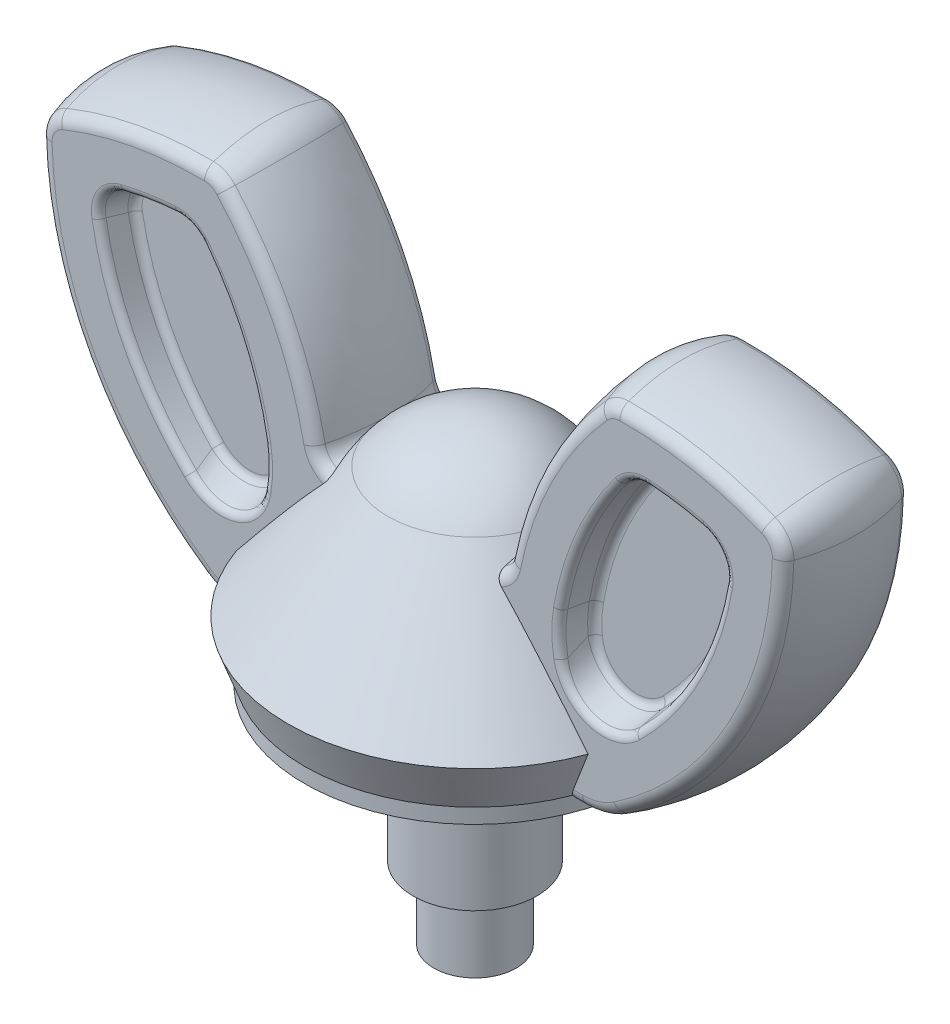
SolidWorks part; units mm, degrees
ref_plane "Front Plane" through (0, 0, 0) normal (0, 0, 1) x (1, 0, 0)
ref_plane "Top Plane" through (0, 0, 0) normal (0, 1, 0) x (1, 0, 0)
ref_plane "Right Plane" through (0, 0, 0) normal (1, 0, 0) x (0, 0, -1)
other "Configuration Table"
sketch "Sketch1" plane through (0, 0, 0) normal (0, 0, 1) x (1, 0, 0)
  line L0 (0, 10.7344) -> (0, 0) construction
  line L5 (4.826, 0) -> (-4.826, 0)
  line L6 (2.413, 5.08) -> (-2.413, 5.08)
  arc A11 (-2.413, 5.08) -> (-5.3975, 10.9034) centre (-13.1787, 3.2391) ccw
  arc A13 (-5.3975, 10.9034) -> (-10.795, 9.8298) centre (-6.0342, 0) ccw
  arc A24 (-10.795, 9.8298) -> (-6.0486, 0.3742) centre (0, 9.3295) ccw
  arc A26 (-4.826, 0) -> (-6.0486, 0.3742) centre (-4.826, 2.1844) cw
  arc A29 (4.826, 0) -> (6.0486, 0.3742) centre (4.826, 2.1844) ccw
  arc A34 (10.795, 9.8298) -> (6.0486, 0.3742) centre (0, 9.3295) cw
  arc A36 (5.3975, 10.9034) -> (10.795, 9.8298) centre (6.0342, 0) cw
  arc A37 (2.413, 5.08) -> (5.3975, 10.9034) centre (13.1787, 3.2391) cw
  point P19 (0, 0)
  point P27 (0, 5.08)
  point P29 (0, 5.08)
  point P44 (0, 5.08)
extrude "Extrude1" add sketch "Sketch1" along normal mid plane 3.556
fillet "Fillet4" radius 1.0922 4 edges at (10.795, 9.8298, 0) (5.3975, 10.9034, 0) (-5.3975, 10.9034, 0) (-10.795, 9.8298, 0)
sketch "Sketch2" plane through (0, 0, 1.778) normal (0, 0, 1) x (1, 0, 0)
  line L0 (0, 0) -> (0, 12.8329) construction
  line L1 (-4.826, 0) -> (4.826, 0) construction
  arc A10 (-4.1864, 4.7767) -> (-5.0416, 1.8652) centre (-7.5893, 4.1949) cw
  arc A11 (4.1864, 4.7767) -> (6.2055, 9.1212) centre (13.1787, 3.2391) cw
  arc A12 (6.2055, 9.1212) -> (8.9805, 8.634) centre (6.0342, 0) cw
  arc A13 (8.9805, 8.634) -> (5.0416, 1.8652) centre (0, 9.3295) cw
  arc A14 (4.1864, 4.7767) -> (5.0416, 1.8652) centre (7.5893, 4.1949) ccw
  arc A15 (-8.9805, 8.634) -> (-5.0416, 1.8652) centre (0, 9.3295) ccw
  arc A16 (-6.2055, 9.1212) -> (-8.9805, 8.634) centre (-6.0342, 0) ccw
  arc A17 (-4.1864, 4.7767) -> (-6.2055, 9.1212) centre (-13.1787, 3.2391) ccw
  arc A18 (-8.9805, 8.634) -> (-5.0416, 1.8652) centre (0, 9.3295) ccw
  arc A19 (-6.2055, 9.1212) -> (-8.9805, 8.634) centre (-6.0342, 0) ccw
  arc A20 (-4.1864, 4.7767) -> (-6.2055, 9.1212) centre (-13.1787, 3.2391) ccw
extrude "Cut-Extrude1" cut sketch "Sketch2" against normal blind 0.889 draft 10
fillet "Fillet1" radius 0.889 4 edges
fillet "Fillet6" radius 1.2446 2 edges
fillet "Fillet5" radius 0.3641 2 edges at (2.413, 5.08, 0) (-2.413, 5.08, 0)
fillet "Fillet3" radius 0.2223 28 edges at (7.4585, 9.011, 1.778) (7.4007, 8.8613, 0.889) (6.4621, 8.9114, 0.889) (8.6146, 8.3041, 0.889) (7.8855, 5.3103, 0.889) (4.2988, 4.3764, 0.889) (6.1282, 8.9579, 1.778) (8.7221, 8.5339, 1.778) (7.9776, 5.1471, 1.778) (4.1377, 4.1292, 1.778) (-4.2988, 4.3764, 0.889) (-7.8855, 5.3103, 0.889) (-8.5332, 8.4279, 0.889) (-7.4007, 8.8613, 0.889) (-6.1942, 8.7899, 0.889) (-4.1377, 4.1292, 1.778) (-7.9776, 5.1471, 1.778) (-8.7866, 8.4358, 1.778) (-7.4585, 9.011, 1.778) (-6.3795, 9.0717, 1.778) (4.9351, 6.7652, 0.889) (4.81, 6.8709, 1.778) (-4.9351, 6.7652, 0.889) (-4.81, 6.8709, 1.778) (4.9742, 2.938, 0.889) (5.0791, 2.5366, 1.778) (-5.2102, 2.8514, 0.889) (-5.0131, 2.5568, 1.778)
mirror "Mirror1" about plane through (0, 0, 0) normal (0, 0, 1) of "Fillet6", "Fillet3", "Fillet1", "Cut-Extrude1"
sketch "Sketch4" plane through (0, 0, 0) normal (1, 0, 0) x (0, 0, -1)
  line L1 (-1.778, 5.334) -> (1.778, 5.334)
  line L2 (-1.778, 4.4704) -> (-1.778, 5.334)
  line L4 (1.778, 0.3742) -> (1.778, 9.0918) construction
  line L6 (-1.778, 9.0918) -> (-1.778, 0.3742) construction
  line L7 (0, 5.715) -> (0, 0.381) construction
  line L9 (1.778, 4.4704) -> (1.778, 5.334)
  line L10 (-1.778, 5.08) -> (1.778, 5.08) construction
  arc A0 (-1.524, 4.826) -> (-1.778, 4.4704) centre (-1.4021, 4.4704) ccw
  arc A1 (1.524, 4.826) -> (-1.524, 4.826) centre (0, 0.381) ccw
  arc A2 (1.524, 4.826) -> (1.778, 4.4704) centre (1.4021, 4.4704) cw
  point P8 (0, 5.08)
sketch3d "3DSketch1"
  line L2 (-2.1102, 5.08, 1.778) -> (2.1102, 5.08, 1.778)
  line L3 (4.826, 0, 1.778) -> (-4.826, 0, 1.778)
  line L4 (-2.1102, 5.08, 1.778) -> (2.1102, 5.08, 1.778)
  line L5 (4.826, 0, 1.778) -> (-4.826, 0, 1.778)
  arc A15 (10.804, 9.0918, 1.778) -> (6.0486, 0.3742, 1.778) centre (0, 9.3295, 1.778) ccw
  arc A16 (10.1207, 10.1287, 1.778) -> (10.804, 9.0918, 1.778) centre (9.712, 9.1158, 1.778) ccw
  arc A17 (5.8682, 10.9207, 1.778) -> (10.1207, 10.1287, 1.778) centre (6.0342, 0, 1.778) ccw
  arc A18 (5.0743, 10.5608, 1.778) -> (5.8682, 10.9207, 1.778) centre (5.8848, 9.8287, 1.778) ccw
  arc A19 (2.4672, 5.3729, 1.778) -> (5.0743, 10.5608, 1.778) centre (13.1787, 3.2391, 1.778) ccw
  arc A20 (2.1102, 5.08, 1.778) -> (2.4672, 5.3729, 1.778) centre (2.1102, 5.4441, 1.778) ccw
  arc A21 (2.1102, 5.08, 1.778) -> (2.4672, 5.3729, 1.778) centre (2.1102, 5.4441, 1.778) ccw
  arc A22 (-5.0743, 10.5608, 1.778) -> (-2.4672, 5.3729, 1.778) centre (-13.1787, 3.2391, 1.778) ccw
  arc A23 (-5.8682, 10.9207, 1.778) -> (-5.0743, 10.5608, 1.778) centre (-5.8848, 9.8287, 1.778) ccw
  arc A24 (-10.1207, 10.1287, 1.778) -> (-5.8682, 10.9207, 1.778) centre (-6.0342, 0, 1.778) ccw
  arc A25 (-10.804, 9.0918, 1.778) -> (-10.1207, 10.1287, 1.778) centre (-9.712, 9.1158, 1.778) ccw
  arc A26 (-6.0486, 0.3742, 1.778) -> (-10.804, 9.0918, 1.778) centre (0, 9.3295, 1.778) ccw
  arc A27 (-4.826, 0, 1.778) -> (-6.0486, 0.3742, 1.778) centre (-4.826, 2.1844, 1.778) ccw
  arc A28 (6.0486, 0.3742, 1.778) -> (4.826, 0, 1.778) centre (4.826, 2.1844, 1.778) ccw
  arc A29 (10.804, 9.0918, 1.778) -> (6.0486, 0.3742, 1.778) centre (0, 9.3295, 1.778) ccw
  arc A30 (10.1207, 10.1287, 1.778) -> (10.804, 9.0918, 1.778) centre (9.712, 9.1158, 1.778) ccw
  arc A31 (5.8682, 10.9207, 1.778) -> (10.1207, 10.1287, 1.778) centre (6.0342, 0, 1.778) ccw
  arc A32 (5.0743, 10.5608, 1.778) -> (5.8682, 10.9207, 1.778) centre (5.8848, 9.8287, 1.778) ccw
  arc A33 (2.4672, 5.3729, 1.778) -> (5.0743, 10.5608, 1.778) centre (13.1787, 3.2391, 1.778) ccw
  arc A34 (-2.4672, 5.3729, 1.778) -> (-2.1102, 5.08, 1.778) centre (-2.1102, 5.4441, 1.778) ccw
  arc A35 (-2.4672, 5.3729, 1.778) -> (-2.1102, 5.08, 1.778) centre (-2.1102, 5.4441, 1.778) ccw
  arc A36 (-5.0743, 10.5608, 1.778) -> (-2.4672, 5.3729, 1.778) centre (-13.1787, 3.2391, 1.778) ccw
  arc A37 (-5.8682, 10.9207, 1.778) -> (-5.0743, 10.5608, 1.778) centre (-5.8848, 9.8287, 1.778) ccw
  arc A38 (-10.1207, 10.1287, 1.778) -> (-5.8682, 10.9207, 1.778) centre (-6.0342, 0, 1.778) ccw
  arc A39 (-10.804, 9.0918, 1.778) -> (-10.1207, 10.1287, 1.778) centre (-9.712, 9.1158, 1.778) ccw
  arc A40 (-6.0486, 0.3742, 1.778) -> (-10.804, 9.0918, 1.778) centre (0, 9.3295, 1.778) ccw
  arc A41 (-4.826, 0, 1.778) -> (-6.0486, 0.3742, 1.778) centre (-4.826, 2.1844, 1.778) ccw
  arc A42 (6.0486, 0.3742, 1.778) -> (4.826, 0, 1.778) centre (4.826, 2.1844, 1.778) ccw
  point P3 (2.1102, 5.4441, 2.1421)
  point P5 (2.1102, 5.4441, 2.1421)
  point P11 (-2.1102, 5.4441, 2.1421)
  point P13 (-2.1102, 5.4441, 2.1421)
  point P43 (0, 9.3295, -9.0286)
  point P46 (9.712, 9.1158, 0.6858)
  point P48 (6.0342, 0, -9.144)
  point P50 (5.8848, 9.8287, 0.6858)
  point P52 (13.1787, 3.2391, -9.144)
  point P58 (-13.1787, 3.2391, -9.144)
  point P60 (-5.8848, 9.8287, 0.6858)
  point P62 (-6.0342, 0, -9.144)
  point P64 (-9.712, 9.1158, 0.6858)
  point P66 (0, 9.3295, -9.0286)
  point P68 (-4.826, 2.1844, -0.4064)
  point P70 (4.826, 2.1844, -0.4064)
  point P71 (0, 9.3295, -9.0286)
  point P72 (9.712, 9.1158, 0.6858)
  point P73 (6.0342, 0, -9.144)
  point P74 (5.8848, 9.8287, 0.6858)
  point P75 (13.1787, 3.2391, -9.144)
  point P78 (-13.1787, 3.2391, -9.144)
  point P79 (-5.8848, 9.8287, 0.6858)
  point P80 (-6.0342, 0, -9.144)
  point P81 (-9.712, 9.1158, 0.6858)
  point P82 (0, 9.3295, -9.0286)
  point P83 (-4.826, 2.1844, -0.4064)
  point P84 (4.826, 2.1844, -0.4064)
  dimension "D1" = 0
sweep "Cut-Sweep2" cut profiles "Sketch4" path "3DSketch1"
sketch "Sketch3" plane through (0, 0, 0) normal (0, 0, 1) x (1, 0, 0)
  line L0 (0, 6.5903) -> (0, -11.3525) construction
  line L1 (1.7526, 0) -> (4.826, 0)
  line L2 (5.2882, 1.6933) -> (2.4672, 5.3729)
  line L4 (1.7526, 0) -> (1.7526, -6.35)
  line L5 (1.7526, -6.35) -> (0, -6.35)
  line L6 (4.826, 0) -> (4.826, 0.4233)
  line L7 (0, 6.5903) -> (0, -6.35)
  line L8 (0, 6.5903) -> (-2.4754, 6.5903) construction
  line L9 (4.826, 0.4233) -> (5.2882, 1.6933)
  arc A1 (2.4672, 5.3729) -> (0, 6.5903) centre (0, 3.4814) ccw
revolve "Revolve1" add sketch "Sketch3" angle 360 about L0
sketch "Sketch6" plane through (0, 0, 0) normal (0, 0, 1) x (1, 0, 0)
  line L0 (0, 4.5862) -> (0, -10.6597) construction
  line L1 (1.1684, -4.699) -> (2.0066, -4.1121)
  line L2 (2.0066, -4.1121) -> (2.0066, -6.604)
  line L3 (2.0066, -6.604) -> (1.1684, -6.604)
  line L4 (1.1684, -6.604) -> (1.1684, -4.699)
  line L5 (-1.7526, -6.35) -> (1.7526, -6.35) construction
  line L8 (1.7526, -6.35) -> (1.7526, 0) construction
  dimension "D1" = 125
  dimension "D2" = 0.254
  dimension "D3" = 0.254
  dimension "Q" = 1.651
  dimension "P" = 2.3368
revolve "Cut-Revolve11" cut sketch "Sketch6" angle 360 about L0
sketch "Sketch5" plane through (0, 0, 0) normal (0, 0, 1) x (1, 0, 0)
  line L0 (1.7526, -0.0254) -> (1.2802, -0.2982)
  line L1 (1.2802, -0.2982) -> (1.7526, -0.5709)
  line L2 (1.7526, -0.5709) -> (1.7526, -0.0254)
  line L3 (0, 0) -> (0, -7.7715) construction
  line L6 (1.2802, -0.2982) -> (1.2802, -1.0906) construction
revolve "Cut-Revolve10" [suppressed] cut sketch "Sketch5" angle 360 about L3
pattern_linear "LPattern10" [suppressed] count 8 spacing 0.7925 along (0, -1, 0)
equation "\"D5@Sketch1\" = \"E@Sketch1\" / 2"
equation "\"D1@Sketch1\" = \"A@Sketch1\" / 4"
equation "\"D3@Sketch1\" = \"B@Sketch1\" * 9 /  10"
equation "\"D4@Sketch1\" = \"B@Sketch1\""
equation "\"D2@Sketch1\" = \"D4@Sketch1\" / 5"
equation "\"D1@Cut-Extrude1\" = \"C@Extrude1\" / 4"
equation "\"D1@Fillet1\" = \"D1@Cut-Extrude1\""
equation "\"D1@Fillet3\" = \"D1@Cut-Extrude1\" / 4"
equation "\"D2@Sketch3\" = \"G@Sketch1\" / 4"
equation "\"D3@Sketch3\" = \"E@Sketch1\""
equation "\"D1@Sketch4\" = \"C@Extrude1\" / 14"
equation "\"D1@Sketch5\" = \"d1@Sketch3\""
equation "\"D2@Sketch5\" = \"THD_MINOR@Cosmetic Thread1\""
equation "\"D3@LPattern10\" = \"pitch@Sketch5\""
equation "\"D1@LPattern10\" = \"L@Sketch3\" / \"D3@LPattern10\""
equation "\"D1@Cosmetic Thread1\" = \"L@Sketch3\""
equation "\"D2@Sketch4\" = \"D1@Sketch4\""
equation "\"D4@Sketch3\" = \"D2@Sketch3\" / 3"
equation "\"D1@Fillet4\" = \"D2@Sketch1\" /2"
equation "\"D1@Sketch2\" = \"D1@Sketch1\" / 3"
equation "\"D1@Fillet5\" = \"D1@Fillet4\" / 3"
equation "\"D1@Fillet6\" = \"D1@Fillet1\" * 1.4"
